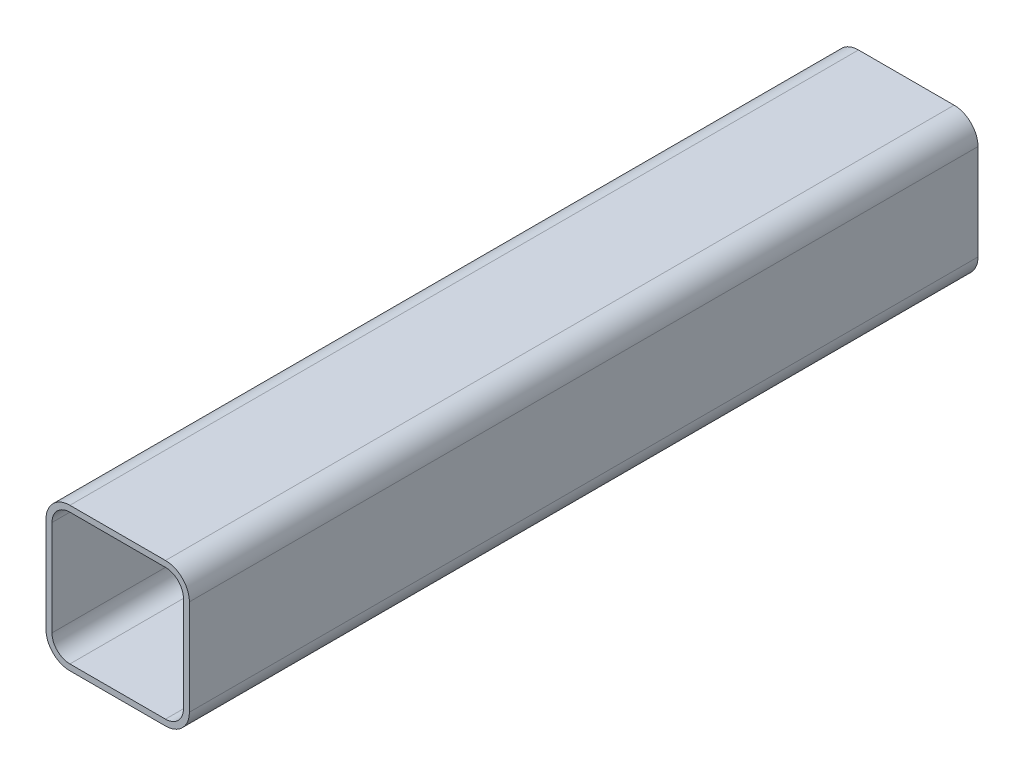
SolidWorks part; units mm, degrees
ref_plane "Front" through (0, 0, 0) normal (0, 0, 1) x (1, 0, 0)
ref_plane "Top" through (0, 0, 0) normal (0, 1, 0) x (1, 0, 0)
ref_plane "Right" through (0, 0, 0) normal (1, 0, 0) x (0, 0, -1)
sketch "Sketch1" plane through (0, 0, 0) normal (0, 0, 1) x (1, 0, 0)
  line L0 (-25.4, 38.1) -> (25.4, 38.1)
  line L1 (-38.1, 25.4) -> (-38.1, -25.4)
  line L2 (25.4, -38.1) -> (-25.4, -38.1)
  line L3 (38.1, -25.4) -> (38.1, 25.4)
  line L4 (0, 38.1) -> (0, -38.1) construction
  arc A0 (38.1, 25.4) -> (25.4, 38.1) centre (25.4, 25.4) ccw
  arc A1 (38.1, -25.4) -> (25.4, -38.1) centre (25.4, -25.4) cw
  arc A2 (-25.4, -38.1) -> (-38.1, -25.4) centre (-25.4, -25.4) cw
  arc A3 (-38.1, 25.4) -> (-25.4, 38.1) centre (-25.4, 25.4) cw
  dimension "D1" = 12.7
  dimension "D2" = 76.2
  dimension "D3" = 76.2
extrude "Base-Extrude-Thin" add sketch "Sketch1" along normal blind 419.1 thin
